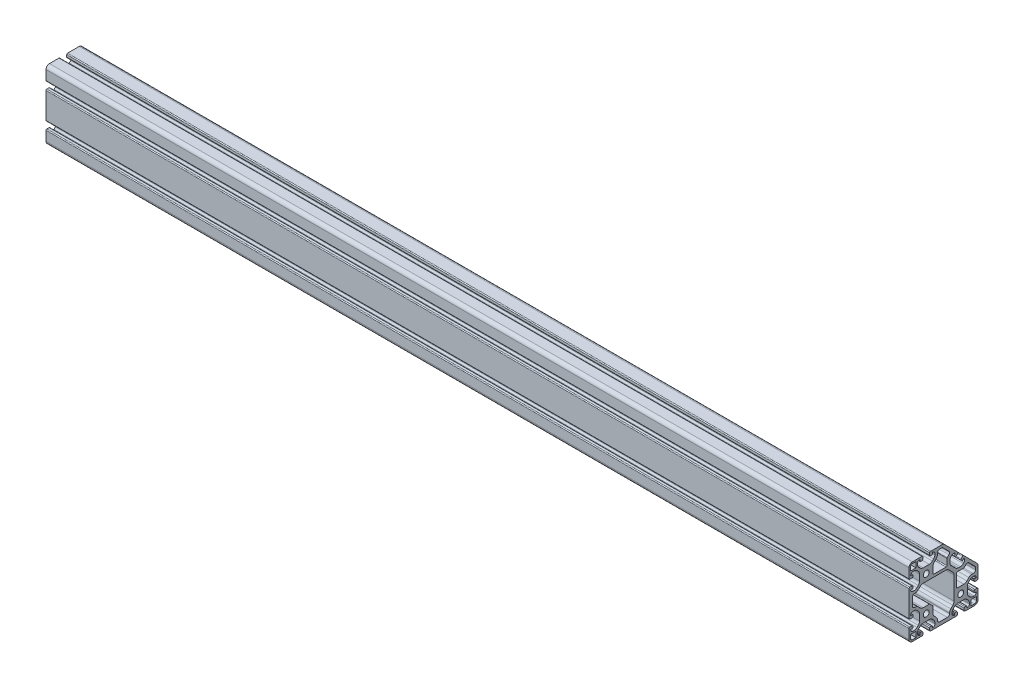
SolidWorks part; units mm, degrees
ref_plane "Ebene vorne" through (0, 0, 0) normal (0, 0, 1) x (1, 0, 0)
ref_plane "Ebene oben" through (0, 0, 0) normal (0, 1, 0) x (1, 0, 0)
ref_plane "Ebene rechts" through (0, 0, 0) normal (1, 0, 0) x (0, 0, -1)
sketch "Skizze1" plane through (0, 0, 0) normal (0, 1, 0) x (1, 0, 0)
  line L0 (0, 0) -> (1000, 0)
  dimension "D1" = 1000
other "Strukturbauteil1"
ref_plane "Ebene1" through (0, 0, 0) normal (1, 0, 0) x (0, 0, -1)
sketch "Model" plane through (0, 0, 0) normal (1, 0, 0) x (0, 0, -1)
  line L0 (-8.4643, -29.4181) -> (-10.7854, -27.097)
  line L1 (-29.2145, 27.0931) -> (-30.6569, 28.5355)
  line L2 (-12.5428, -15.7452) -> (-15.7412, -12.5467)
  line L3 (-29.2145, -12.9069) -> (-30.6569, -11.4645)
  line L4 (-11.4645, -30.6569) -> (-12.9069, -29.2145)
  line L5 (-27.093, -10.7894) -> (-29.4141, -8.4683)
  line L6 (36.2679, -0.5142) -> (29.546, 6.2075)
  line L7 (10.7857, 6.2297) -> (6.2336, 10.7817)
  line L8 (13.8517, 8.8204) -> (8.8204, 13.8517)
  line L9 (21.4123, 12.2199) -> (20.3517, 13.2806)
  line L10 (23.8872, 13.2806) -> (23.8518, 13.3159)
  line L11 (13.2806, 20.3517) -> (12.2199, 21.4123)
  line L12 (16.4645, 23.5355) -> (1.1716, 38.8284)
  line L13 (38.8284, 1.1716) -> (23.5355, 16.4645)
  line L14 (13.3159, 23.8518) -> (13.2806, 23.8872)
  line L15 (28.5355, -30.6569) -> (27.0931, -29.2145)
  line L16 (30.6569, -28.5355) -> (29.2145, -27.0931)
  line L17 (6.2116, 29.5421) -> (-0.5103, 36.2639)
  line L18 (-27.0931, 29.2145) -> (-28.5355, 30.6569)
  line L19 (-36, -40) -> (-25, -40)
  line L20 (-15, -40) -> (15, -40)
  line L21 (25, -40) -> (36, -40)
  line L22 (31.8001, -38.2038) -> (36.0001, -38.2038)
  line L23 (-35.9999, -38.2038) -> (-31.7999, -38.2038)
  line L24 (-27.5, -38) -> (-27.45, -38)
  line L25 (-12.55, -38) -> (-12.5, -38)
  line L26 (12.5, -38) -> (12.55, -38)
  line L27 (27.45, -38) -> (27.5, -38)
  line L28 (-4.4999, -36.0038) -> (4.5001, -36.0038)
  line L29 (-26.5, -35.5) -> (-25, -35.5)
  line L30 (-15, -35.5) -> (-13.5, -35.5)
  line L31 (13.5, -35.5) -> (15, -35.5)
  line L32 (25, -35.5) -> (26.5, -35.5)
  line L33 (31.8001, -31.8038) -> (38.2001, -31.8038)
  line L34 (-38.1999, -31.8038) -> (-31.7999, -31.8038)
  line L35 (-35.5, -30) -> (-34.1924, -30)
  line L36 (34.1924, -30) -> (35.5, -30)
  line L37 (-23.5576, -27.75) -> (-16.4424, -27.75)
  line L38 (16.4424, -27.75) -> (23.5576, -27.75)
  line L39 (-37.55, -27) -> (-36, -27)
  line L40 (36, -27) -> (37.55, -27)
  line L41 (-39, -24) -> (-36.5, -24)
  line L42 (36.5, -24) -> (39, -24)
  line L43 (-39, -16) -> (-36.5, -16)
  line L44 (36.5, -16) -> (39, -16)
  line L45 (-37.55, -13) -> (-36, -13)
  line L46 (36, -13) -> (37.55, -13)
  line L47 (16.2503, -12.2542) -> (23.5579, -12.254)
  line L48 (-23.5575, -12.2538) -> (-16.4484, -12.2538)
  line L49 (-35.5, -10) -> (-34.1924, -10)
  line L50 (34.1924, -10) -> (35.5, -10)
  line L51 (32.9499, -7.0038) -> (34.5001, -7.0038)
  line L52 (-33.4999, -7.0038) -> (-32.9496, -7.0038)
  line L53 (16.2501, 3.9958) -> (23.3848, 3.996)
  line L54 (-33.4999, 6.9962) -> (-32.9496, 6.9962)
  line L55 (17.3872, 7.356) -> (19.427, 7.356)
  line L56 (-35.5, 10) -> (-34.1924, 10)
  line L57 (-23.5575, 12.2462) -> (2.6981, 12.2462)
  line L58 (-37.55, 13) -> (-36, 13)
  line L59 (-11.2499, 15.2462) -> (3.0001, 15.2462)
  line L60 (-39, 16) -> (-36.5, 16)
  line L61 (-39, 24) -> (-36.5, 24)
  line L62 (-37.55, 27) -> (-36, 27)
  line L63 (-23.5576, 27.75) -> (-16.4424, 27.75)
  line L64 (-35.5, 30) -> (-34.1924, 30)
  line L65 (-38.1999, 31.7962) -> (-31.7999, 31.7962)
  line L66 (-15, 35.5) -> (-13.5, 35.5)
  line L67 (-26.5, 35.5) -> (-25, 35.5)
  line L68 (-4.4999, 36.9962) -> (-2.278, 36.9962)
  line L69 (-12.55, 38) -> (-12.5, 38)
  line L70 (-27.5, 38) -> (-27.45, 38)
  line L71 (-35.9999, 38.1962) -> (-31.7999, 38.1962)
  line L72 (-15, 40) -> (-1.6569, 40)
  line L73 (-36, 40) -> (-25, 40)
  line L74 (8.4646, -29.4181) -> (10.7857, -27.097)
  line L75 (22.9626, 8.8204) -> (23.8872, 9.7451)
  line L76 (-30.6569, 11.4645) -> (-29.2145, 12.9069)
  line L77 (14.6948, 20.3517) -> (16.4626, 22.1194)
  line L78 (-28.5355, -30.6569) -> (-27.0931, -29.2145)
  line L79 (-30.6569, -28.5355) -> (-29.2145, -27.0931)
  line L80 (27.0934, -10.7895) -> (29.4145, -8.4684)
  line L81 (-29.4141, 8.4606) -> (-27.093, 10.7817)
  line L82 (22.1194, 12.2199) -> (23.2154, 13.3159)
  line L83 (23.5336, 16.4626) -> (23.5355, 16.4645)
  line L84 (12.2199, 22.1194) -> (13.3159, 23.2154)
  line L85 (16.4626, 23.5336) -> (16.4645, 23.5355)
  line L86 (4.293, 24.088) -> (6.2116, 26.0066)
  line L87 (-10.7854, 27.0893) -> (-8.4643, 29.4104)
  line L88 (11.4645, -30.6569) -> (12.9069, -29.2145)
  line L89 (20.3517, 14.6948) -> (22.1194, 16.4626)
  line L90 (8.8204, 22.9626) -> (9.7451, 23.8872)
  line L91 (-12.9069, 29.2145) -> (-11.4645, 30.6569)
  line L92 (29.2145, -12.9069) -> (30.6569, -11.4645)
  line L93 (24.0919, 4.2889) -> (26.0104, 6.2074)
  line L94 (-40, 25) -> (-40, 36)
  line L95 (-40, -15) -> (-40, 15)
  line L96 (-40, -36) -> (-40, -25)
  line L97 (-38.1999, 31.7962) -> (-38.1999, 35.9962)
  line L98 (-38.1999, -36.0038) -> (-38.1999, -31.8038)
  line L99 (-38, 27.45) -> (-38, 27.5)
  line L100 (-38, 12.5) -> (-38, 12.55)
  line L101 (-38, -12.55) -> (-38, -12.5)
  line L102 (-38, -27.5) -> (-38, -27.45)
  line L103 (-35.9999, -4.5038) -> (-35.9999, 4.4962)
  line L104 (-35.5, 25) -> (-35.5, 26.5)
  line L105 (-35.5, 13.5) -> (-35.5, 15)
  line L106 (-35.5, -15) -> (-35.5, -13.5)
  line L107 (-35.5, -26.5) -> (-35.5, -25)
  line L108 (-31.7999, 31.7962) -> (-31.7999, 38.1962)
  line L109 (-31.7999, -38.2038) -> (-31.7999, -31.8038)
  line L110 (-30, 34.1924) -> (-30, 35.5)
  line L111 (-30, -35.5) -> (-30, -34.1924)
  line L112 (-27.75, 16.4424) -> (-27.75, 23.5576)
  line L113 (-27.75, -23.5576) -> (-27.75, -16.4424)
  line L114 (-27, 36) -> (-27, 37.55)
  line L115 (-27, -37.55) -> (-27, -36)
  line L116 (-24, 36.5) -> (-24, 39)
  line L117 (-24, -39) -> (-24, -36.5)
  line L118 (-16, 36.5) -> (-16, 39)
  line L119 (-16, -39) -> (-16, -36.5)
  line L120 (-13, 36) -> (-13, 37.55)
  line L121 (-13, -37.55) -> (-13, -36)
  line L122 (-12.2499, 16.2462) -> (-12.2499, 23.5538)
  line L123 (-12.2499, -23.5615) -> (-12.2499, -16.4523)
  line L124 (-10, 34.1924) -> (-10, 35.5)
  line L125 (-10, -35.5) -> (-10, -34.1924)
  line L126 (-6.9999, 32.9459) -> (-6.9999, 34.4962)
  line L127 (-6.9999, -33.5038) -> (-6.9999, -32.9536)
  line L128 (4.0001, 16.2462) -> (4.0001, 23.3809)
  line L129 (7.0001, -33.5038) -> (7.0001, -32.9536)
  line L130 (7.356, 17.3872) -> (7.356, 19.427)
  line L131 (10, -35.5) -> (10, -34.1924)
  line L132 (12.2501, -23.5615) -> (12.2501, 2.6941)
  line L133 (13, -37.55) -> (13, -36)
  line L134 (15.2503, -11.2542) -> (15.2501, 2.9958)
  line L135 (16, -39) -> (16, -36.5)
  line L136 (24, -39) -> (24, -36.5)
  line L137 (27, -37.55) -> (27, -36)
  line L138 (27.75, -23.5576) -> (27.75, -16.4424)
  line L139 (30, -35.5) -> (30, -34.1924)
  line L140 (31.8001, -38.2038) -> (31.8001, -31.8038)
  line L141 (35.5, -26.5) -> (35.5, -25)
  line L142 (35.5, -15) -> (35.5, -13.5)
  line L143 (37.0001, -4.5038) -> (37.0001, -2.282)
  line L144 (38, -27.5) -> (38, -27.45)
  line L145 (38, -12.55) -> (38, -12.5)
  line L146 (38.2001, -36.0038) -> (38.2001, -31.8038)
  line L147 (40, -36) -> (40, -25)
  line L148 (40, -15) -> (40, -1.6569)
  line L149 (0, 40) -> (40, 0) construction
  line L150 (0, 40) -> (-40, 40) construction
  line L151 (40, 0) -> (40, -40) construction
  line L152 (40, -40) -> (-40, -40) construction
  line L153 (-40, 40) -> (-40, -40) construction
  line L154 (20, 20) -> (-40, -40) construction
  line L155 (40, -40) -> (-40, 40) construction
  arc A0 (-39, -24) -> (-40, -25) centre (-39, -25) ccw
  arc A1 (-40, -15) -> (-39, -16) centre (-39, -15) ccw
  arc A2 (-39, 16) -> (-40, 15) centre (-39, 15) ccw
  arc A3 (-40, 25) -> (-39, 24) centre (-39, 25) ccw
  arc A4 (-37.55, -27) -> (-38, -27.45) centre (-37.55, -27.45) ccw
  arc A5 (-38, -12.55) -> (-37.55, -13) centre (-37.55, -12.55) ccw
  arc A6 (-37.55, 13) -> (-38, 12.55) centre (-37.55, 12.55) ccw
  arc A7 (-38, 27.45) -> (-37.55, 27) centre (-37.55, 27.45) ccw
  arc A8 (-35.5, -25) -> (-36.5, -24) centre (-36.5, -25) ccw
  arc A9 (-36.5, -16) -> (-35.5, -15) centre (-36.5, -15) ccw
  arc A10 (-35.5, 15) -> (-36.5, 16) centre (-36.5, 15) ccw
  arc A11 (-36.5, 24) -> (-35.5, 25) centre (-36.5, 25) ccw
  arc A12 (-40, -36) -> (-36, -40) centre (-36, -36) ccw
  arc A13 (-36, -27) -> (-35.5, -26.5) centre (-36, -26.5) ccw
  arc A14 (-35.5, -13.5) -> (-36, -13) centre (-36, -13.5) ccw
  arc A15 (-36, 13) -> (-35.5, 13.5) centre (-36, 13.5) ccw
  arc A16 (-35.5, 26.5) -> (-36, 27) centre (-36, 26.5) ccw
  arc A17 (-36, 40) -> (-40, 36) centre (-36, 36) ccw
  arc A18 (-38.1999, -36.0038) -> (-35.9999, -38.2038) centre (-35.9999, -36.0038) ccw
  arc A19 (-35.9999, 38.1962) -> (-38.1999, 35.9962) centre (-35.9999, 35.9962) ccw
  arc A20 (-38, -27.5) -> (-35.5, -30) centre (-35.5, -27.5) ccw
  arc A21 (-35.5, -10) -> (-38, -12.5) centre (-35.5, -12.5) ccw
  arc A22 (-38, 12.5) -> (-35.5, 10) centre (-35.5, 12.5) ccw
  arc A23 (-35.5, 30) -> (-38, 27.5) centre (-35.5, 27.5) ccw
  arc A24 (-34.1924, -30) -> (-30.6569, -28.5355) centre (-34.1924, -25) ccw
  arc A25 (-30.6569, -11.4645) -> (-34.1924, -10) centre (-34.1924, -15) ccw
  arc A26 (-34.1924, 10) -> (-30.6569, 11.4645) centre (-34.1924, 15) ccw
  arc A27 (-30.6569, 28.5355) -> (-34.1924, 30) centre (-34.1924, 25) ccw
  arc A28 (-35.9999, -4.5038) -> (-33.4999, -7.0038) centre (-33.4999, -4.5038) ccw
  arc A29 (-33.4999, 6.9962) -> (-35.9999, 4.4962) centre (-33.4999, 4.4962) ccw
  arc A30 (-29.4141, -8.4683) -> (-32.9496, -7.0038) centre (-32.9496, -12.0038) ccw
  arc A31 (-32.9496, 6.9962) -> (-29.4141, 8.4606) centre (-32.9496, 11.9962) ccw
  arc A32 (-29.2145, -27.0931) -> (-27.75, -23.5576) centre (-32.75, -23.5576) ccw
  arc A33 (-27.75, -16.4424) -> (-29.2145, -12.9069) centre (-32.75, -16.4424) ccw
  arc A34 (-29.2145, 12.9069) -> (-27.75, 16.4424) centre (-32.75, 16.4424) ccw
  arc A35 (-27.75, 23.5576) -> (-29.2145, 27.0931) centre (-32.75, 23.5576) ccw
  arc A36 (-30, -35.5) -> (-27.5, -38) centre (-27.5, -35.5) ccw
  arc A37 (-27.5, 38) -> (-30, 35.5) centre (-27.5, 35.5) ccw
  arc A38 (-27.45, -38) -> (-27, -37.55) centre (-27.45, -37.55) ccw
  arc A39 (-27, 37.55) -> (-27.45, 38) centre (-27.45, 37.55) ccw
  arc A40 (-26.5, -35.5) -> (-27, -36) centre (-26.5, -36) ccw
  arc A41 (-27, 36) -> (-26.5, 35.5) centre (-26.5, 36) ccw
  arc A42 (-25, -40) -> (-24, -39) centre (-25, -39) ccw
  arc A43 (-24, -36.5) -> (-25, -35.5) centre (-25, -36.5) ccw
  arc A44 (-28.5355, -30.6569) -> (-30, -34.1924) centre (-25, -34.1924) ccw
  arc A45 (-30, 34.1924) -> (-28.5355, 30.6569) centre (-25, 34.1924) ccw
  arc A46 (-25, 35.5) -> (-24, 36.5) centre (-25, 36.5) ccw
  arc A47 (-24, 39) -> (-25, 40) centre (-25, 39) ccw
  arc A48 (-23.5576, -27.75) -> (-27.0931, -29.2145) centre (-23.5576, -32.75) ccw
  arc A49 (-27.0931, 29.2145) -> (-23.5576, 27.75) centre (-23.5576, 32.75) ccw
  arc A50 (-27.093, -10.7894) -> (-23.5575, -12.2538) centre (-23.5575, -7.2538) ccw
  arc A51 (-23.5575, 12.2462) -> (-27.093, 10.7817) centre (-23.5575, 7.2462) ccw
  circle A52 centre (-20, -20) radius 3.4
  circle A53 centre (-20, 20) radius 3.4
  arc A54 (-15.7412, -12.5467) -> (-16.4484, -12.2538) centre (-16.4484, -13.2538) ccw
  arc A55 (-12.9069, -29.2145) -> (-16.4424, -27.75) centre (-16.4424, -32.75) ccw
  arc A56 (-16.4424, 27.75) -> (-12.9069, 29.2145) centre (-16.4424, 32.75) ccw
  arc A57 (-16, -39) -> (-15, -40) centre (-15, -39) ccw
  arc A58 (-15, -35.5) -> (-16, -36.5) centre (-15, -36.5) ccw
  arc A59 (-10, -34.1924) -> (-11.4645, -30.6569) centre (-15, -34.1924) ccw
  arc A60 (-11.4645, 30.6569) -> (-10, 34.1924) centre (-15, 34.1924) ccw
  arc A61 (-16, 36.5) -> (-15, 35.5) centre (-15, 36.5) ccw
  arc A62 (-15, 40) -> (-16, 39) centre (-15, 39) ccw
  arc A63 (-13, -36) -> (-13.5, -35.5) centre (-13.5, -36) ccw
  arc A64 (-13.5, 35.5) -> (-13, 36) centre (-13.5, 36) ccw
  arc A65 (-12.2499, -16.4523) -> (-12.5428, -15.7452) centre (-13.2499, -16.4523) ccw
  arc A66 (-13, -37.55) -> (-12.55, -38) centre (-12.55, -37.55) ccw
  arc A67 (-12.55, 38) -> (-13, 37.55) centre (-12.55, 37.55) ccw
  arc A68 (-12.5, -38) -> (-10, -35.5) centre (-12.5, -35.5) ccw
  arc A69 (-10, 35.5) -> (-12.5, 38) centre (-12.5, 35.5) ccw
  arc A70 (-8.4643, 29.4104) -> (-6.9999, 32.9459) centre (-11.9999, 32.9459) ccw
  arc A71 (-6.9999, -32.9536) -> (-8.4643, -29.4181) centre (-11.9999, -32.9536) ccw
  arc A72 (-12.2499, 16.2462) -> (-11.2499, 15.2462) centre (-11.2499, 16.2462) ccw
  arc A73 (-12.2499, -23.5615) -> (-10.7854, -27.097) centre (-7.2499, -23.5615) ccw
  arc A74 (-10.7854, 27.0893) -> (-12.2499, 23.5538) centre (-7.2499, 23.5538) ccw
  arc A75 (-4.4999, 36.9962) -> (-6.9999, 34.4962) centre (-4.4999, 34.4962) ccw
  arc A76 (-6.9999, -33.5038) -> (-4.4999, -36.0038) centre (-4.4999, -33.5038) ccw
  arc A77 (-0.5103, 36.2639) -> (-2.278, 36.9962) centre (-2.278, 34.4962) ccw
  arc A78 (1.1716, 38.8284) -> (-1.6569, 40) centre (-1.6569, 36) ccw
  arc A79 (6.2336, 10.7817) -> (2.6981, 12.2462) centre (2.6981, 7.2462) ccw
  arc A80 (3.0001, 15.2462) -> (4.0001, 16.2462) centre (3.0001, 16.2462) ccw
  arc A81 (6.2116, 26.0066) -> (6.2116, 29.5421) centre (4.4438, 27.7743) ccw
  arc A82 (4.5001, -36.0038) -> (7.0001, -33.5038) centre (4.5001, -33.5038) ccw
  arc A83 (4.293, 24.088) -> (4.0001, 23.3809) centre (5.0001, 23.3809) ccw
  arc A84 (10.7857, -27.097) -> (12.2501, -23.5615) centre (7.2501, -23.5615) ccw
  arc A85 (12.2501, 2.6941) -> (10.7857, 6.2297) centre (7.2501, 2.6941) ccw
  arc A86 (13.2806, 23.8872) -> (9.7451, 23.8872) centre (11.5128, 22.1194) ccw
  arc A87 (8.4646, -29.4181) -> (7.0001, -32.9536) centre (12.0001, -32.9536) ccw
  arc A88 (7.356, 17.3872) -> (8.8204, 13.8517) centre (12.356, 17.3872) ccw
  arc A89 (8.8204, 22.9626) -> (7.356, 19.427) centre (12.356, 19.427) ccw
  arc A90 (10, -35.5) -> (12.5, -38) centre (12.5, -35.5) ccw
  arc A91 (12.55, -38) -> (13, -37.55) centre (12.55, -37.55) ccw
  arc A92 (12.2199, 22.1194) -> (12.2199, 21.4123) centre (12.5735, 21.7659) ccw
  arc A93 (13.3159, 23.2154) -> (13.3159, 23.8518) centre (12.9977, 23.5336) ccw
  arc A94 (13.5, -35.5) -> (13, -36) centre (13.5, -36) ccw
  arc A95 (13.2806, 20.3517) -> (14.6948, 20.3517) centre (13.9877, 21.0588) ccw
  arc A96 (15, -40) -> (16, -39) centre (15, -39) ccw
  arc A97 (16, -36.5) -> (15, -35.5) centre (15, -36.5) ccw
  arc A98 (11.4645, -30.6569) -> (10, -34.1924) centre (15, -34.1924) ccw
  arc A99 (16.4626, 22.1194) -> (16.4626, 23.5336) centre (15.7555, 22.8265) ccw
  arc A100 (15.2503, -11.2542) -> (16.2503, -12.2542) centre (16.2503, -11.2542) ccw
  arc A101 (16.2501, 3.9958) -> (15.2501, 2.9958) centre (16.2501, 2.9958) ccw
  arc A102 (16.4424, -27.75) -> (12.9069, -29.2145) centre (16.4424, -32.75) ccw
  arc A103 (13.8517, 8.8204) -> (17.3872, 7.356) centre (17.3872, 12.356) ccw
  arc A104 (19.427, 7.356) -> (22.9626, 8.8204) centre (19.427, 12.356) ccw
  circle A105 centre (20, -20) radius 3.4
  arc A106 (20.3517, 14.6948) -> (20.3517, 13.2806) centre (21.0588, 13.9877) ccw
  arc A107 (21.4123, 12.2199) -> (22.1194, 12.2199) centre (21.7659, 12.5735) ccw
  arc A108 (23.8872, 9.7451) -> (23.8872, 13.2806) centre (22.1194, 11.5128) ccw
  arc A109 (23.5336, 16.4626) -> (22.1194, 16.4626) centre (22.8265, 15.7555) ccw
  arc A110 (23.3848, 3.996) -> (24.0919, 4.2889) centre (23.3848, 4.996) ccw
  arc A111 (23.8518, 13.3159) -> (23.2154, 13.3159) centre (23.5336, 12.9977) ccw
  arc A112 (27.0931, -29.2145) -> (23.5576, -27.75) centre (23.5576, -32.75) ccw
  arc A113 (23.5579, -12.254) -> (27.0934, -10.7895) centre (23.5578, -7.254) ccw
  arc A114 (24, -39) -> (25, -40) centre (25, -39) ccw
  arc A115 (25, -35.5) -> (24, -36.5) centre (25, -36.5) ccw
  arc A116 (30, -34.1924) -> (28.5355, -30.6569) centre (25, -34.1924) ccw
  arc A117 (27, -36) -> (26.5, -35.5) centre (26.5, -36) ccw
  arc A118 (27, -37.55) -> (27.45, -38) centre (27.45, -37.55) ccw
  arc A119 (27.5, -38) -> (30, -35.5) centre (27.5, -35.5) ccw
  arc A120 (29.546, 6.2075) -> (26.0104, 6.2074) centre (27.7782, 4.4397) ccw
  arc A121 (27.75, -23.5576) -> (29.2145, -27.0931) centre (32.75, -23.5576) ccw
  arc A122 (29.2145, -12.9069) -> (27.75, -16.4424) centre (32.75, -16.4424) ccw
  arc A123 (32.9499, -7.0038) -> (29.4145, -8.4684) centre (32.9501, -12.0038) ccw
  arc A124 (30.6569, -28.5355) -> (34.1924, -30) centre (34.1924, -25) ccw
  arc A125 (34.1924, -10) -> (30.6569, -11.4645) centre (34.1924, -15) ccw
  arc A126 (37.0001, -2.282) -> (36.2679, -0.5142) centre (34.5001, -2.282) ccw
  arc A127 (34.5001, -7.0038) -> (37.0001, -4.5038) centre (34.5001, -4.5038) ccw
  arc A128 (35.5, -30) -> (38, -27.5) centre (35.5, -27.5) ccw
  arc A129 (38, -12.5) -> (35.5, -10) centre (35.5, -12.5) ccw
  arc A130 (36, -40) -> (40, -36) centre (36, -36) ccw
  arc A131 (35.5, -26.5) -> (36, -27) centre (36, -26.5) ccw
  arc A132 (36, -13) -> (35.5, -13.5) centre (36, -13.5) ccw
  arc A134 (36.0001, -38.2038) -> (38.2001, -36.0038) centre (36.0001, -36.0038) ccw
  arc A135 (36.5, -24) -> (35.5, -25) centre (36.5, -25) ccw
  arc A136 (35.5, -15) -> (36.5, -16) centre (36.5, -15) ccw
  arc A137 (38, -27.45) -> (37.55, -27) centre (37.55, -27.45) ccw
  arc A138 (37.55, -13) -> (38, -12.55) centre (37.55, -12.55) ccw
  arc A139 (40, -25) -> (39, -24) centre (39, -25) ccw
  arc A140 (39, -16) -> (40, -15) centre (39, -15) ccw
  arc A146 (40, -1.6569) -> (38.8284, 1.1716) centre (36, -1.6569) ccw
  point P232 (0, 0)
  point P431 (0, 0)
  point P432 (0, 0)
  point P441 (20, 20)
  point P442 (-20, 40)
  point P443 (-40, 20)
  point P444 (-40, -20)
  point P445 (-20, -40)
  point P446 (20, -40)
  point P447 (40, -20)
